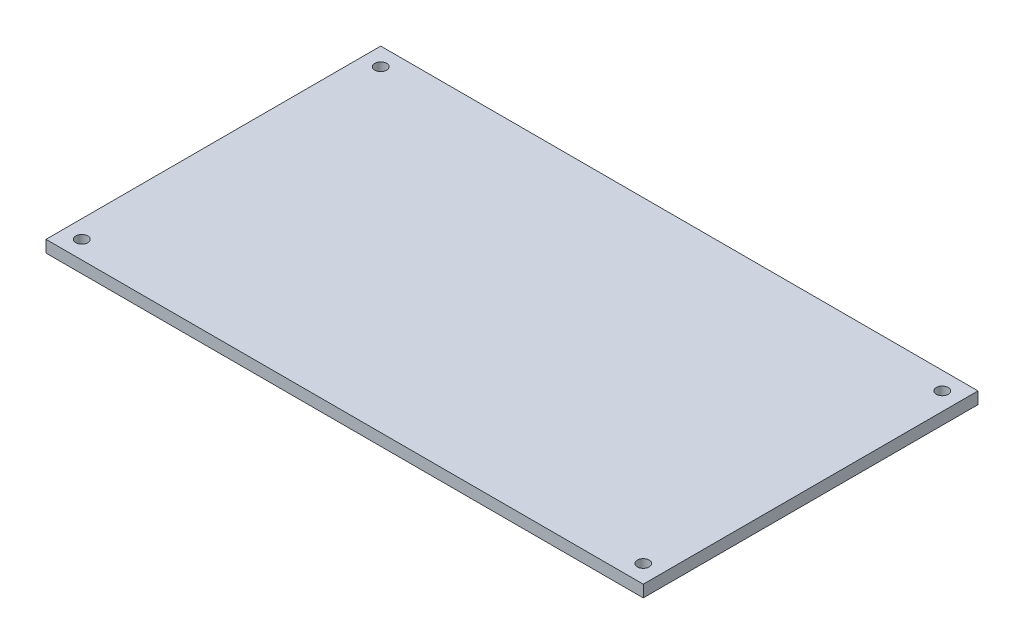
SolidWorks part; units mm, degrees
ref_plane "Front Plane" through (0, 0, 0) normal (0, 0, 1) x (1, 0, 0)
ref_plane "Top Plane" through (0, 0, 0) normal (0, 1, 0) x (1, 0, 0)
ref_plane "Right Plane" through (0, 0, 0) normal (1, 0, 0) x (0, 0, -1)
sketch "Sketch1" plane through (0, 0, 0) normal (0, 1, 0) x (1, 0, 0)
  line L0 (3, 53.1) -> (97.1, 53.1) construction
  line L1 (0, 0) -> (100.1, 0)
  line L2 (0, 0) -> (0, 56.1)
  line L3 (0, 56.1) -> (100.1, 56.1)
  line L4 (100.1, 0) -> (100.1, 56.1)
  line L5 (97.1, 3) -> (97.1, 53.1) construction
  line L6 (3, 3) -> (97.1, 3) construction
  line L7 (3, 3) -> (3, 53.1) construction
  circle A0 centre (3, 53.1) radius 1
  circle A1 centre (97.1, 53.1) radius 1
  circle A2 centre (97.1, 3) radius 1
  circle A3 centre (3, 3) radius 1
  dimension "D4" = 2
  dimension "D5" = 2
  dimension "D6" = 2
  dimension "D7" = 2
  dimension "D1" = 56.1
  dimension "D2" = 100.1
  dimension "D3" = 3
extrude "Boss-Extrude1" add sketch "Sketch1" along normal blind 2
